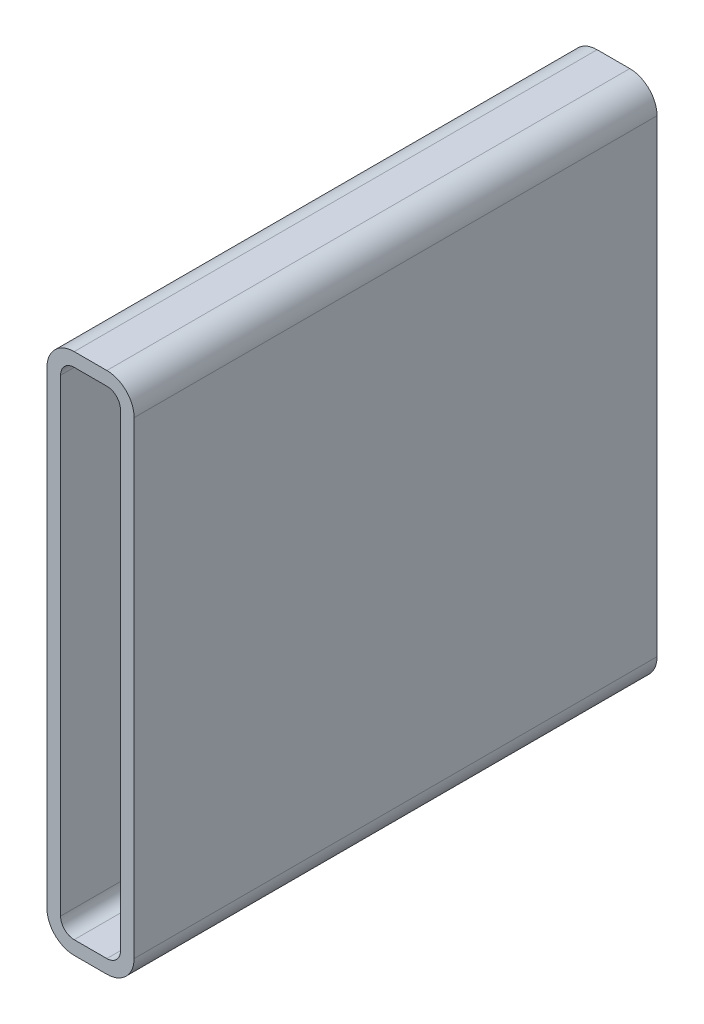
SolidWorks part; units mm, degrees
ref_plane "Front Plane" through (0, 0, 0) normal (0, 0, 1) x (1, 0, 0)
ref_plane "Top Plane" through (0, 0, 0) normal (0, 1, 0) x (1, 0, 0)
ref_plane "Right Plane" through (0, 0, 0) normal (1, 0, 0) x (0, 0, -1)
sketch "Sketch1" plane through (0, 0, 0) normal (0, 0, 1) x (1, 0, 0)
  line B0 (15.875, 304.8) -> (34.925, 304.8)
  arc B1 (50.8, 288.925) -> (34.925, 304.8) centre (34.925, 288.925) ccw
  line B2 (50.8, 288.925) -> (50.8, 15.875)
  arc B3 (34.925, 0) -> (50.8, 15.875) centre (34.925, 15.875) ccw
  line B4 (34.925, 0) -> (15.875, 0)
  arc B5 (0, 15.875) -> (15.875, 0) centre (15.875, 15.875) ccw
  line B6 (0, 15.875) -> (0, 288.925)
  arc B7 (15.875, 304.8) -> (0, 288.925) centre (15.875, 288.925) ccw
  line B8 (15.875, 296.8625) -> (34.925, 296.8625)
  arc B9 (42.8625, 288.925) -> (34.925, 296.8625) centre (34.925, 288.925) ccw
  line B10 (42.8625, 288.925) -> (42.8625, 15.875)
  arc B11 (34.925, 7.9375) -> (42.8625, 15.875) centre (34.925, 15.875) ccw
  line B12 (34.925, 7.9375) -> (15.875, 7.9375)
  arc B13 (7.9375, 15.875) -> (15.875, 7.9375) centre (15.875, 15.875) ccw
  line B14 (7.9375, 15.875) -> (7.9375, 288.925)
  arc B15 (15.875, 296.8625) -> (7.9375, 288.925) centre (15.875, 288.925) ccw
sketch_block_instance "HSS12x2x0.3125-1"
sketch_block "HSS12x2x0.3125"
extrude "Boss-Extrude1" add sketch "Sketch1" along normal blind 304.8
